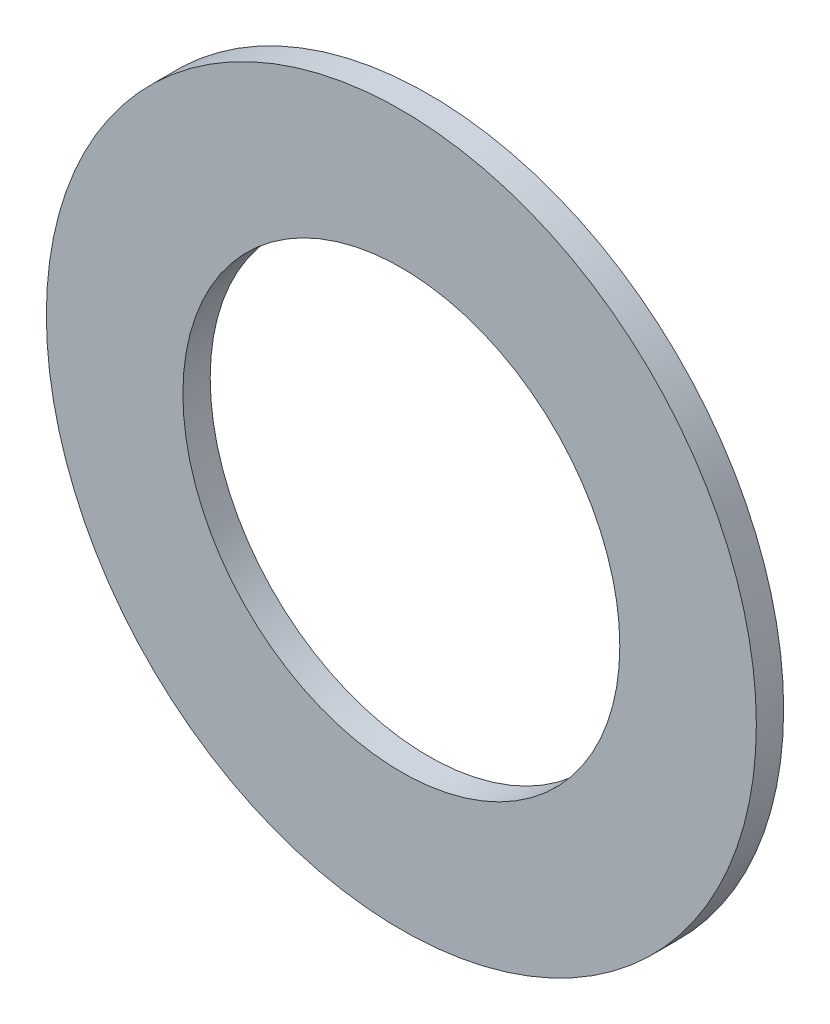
SolidWorks part; units mm, degrees
ref_plane "Plan1" through (0, 0, 0) normal (0, 0, 1) x (1, 0, 0)
ref_plane "Plan2" through (0, 0, 0) normal (0, 1, 0) x (1, 0, 0)
ref_plane "Plan3" through (0, 0, 0) normal (1, 0, 0) x (0, 0, -1)
sketch "Esquisse1" plane through (0, 0, 0) normal (0, 0, 1) x (1, 0, 0)
  circle A0 centre (0, 0) radius 4 construction
  circle A1 centre (0, 0) radius 4
  circle A2 centre (0, 0) radius 6.5
  dimension "D1" = 2.5
extrude "Base-Extrusion" add sketch "Esquisse1" along normal blind 0.5
